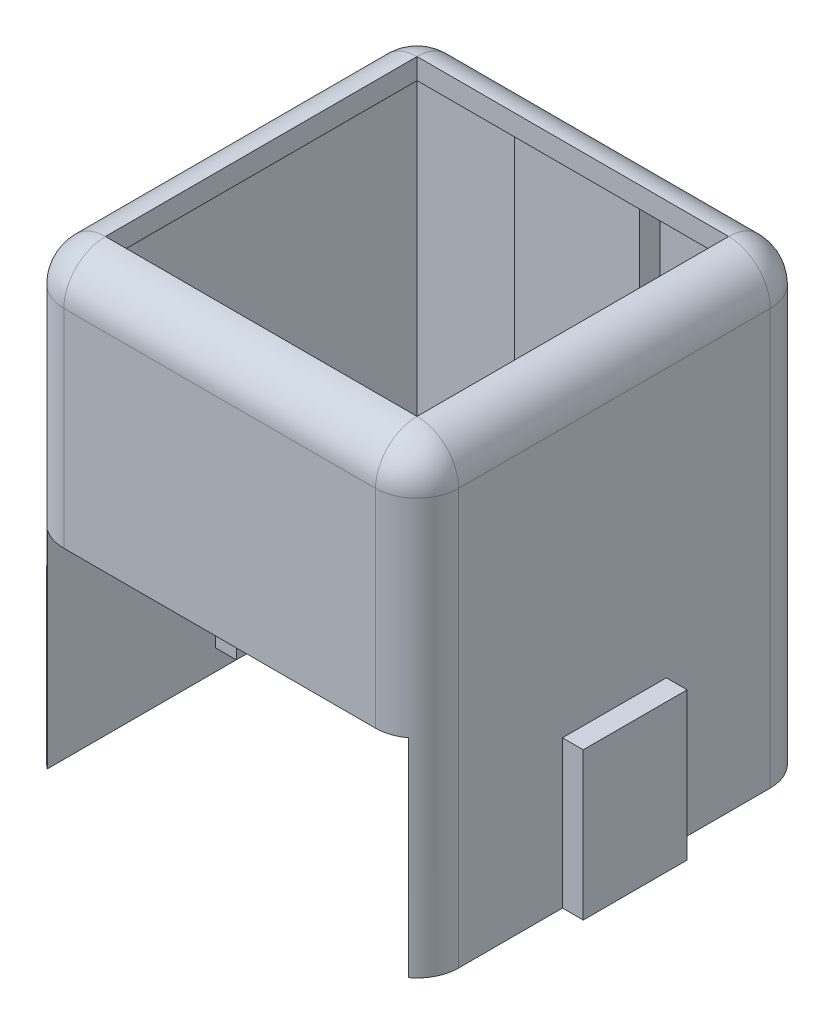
SolidWorks part; units mm, degrees
ref_plane "Front Plane" through (0, 0, 0) normal (0, 0, 1) x (1, 0, 0)
ref_plane "Top Plane" through (0, 0, 0) normal (0, 1, 0) x (1, 0, 0)
ref_plane "Right Plane" through (0, 0, 0) normal (1, 0, 0) x (0, 0, -1)
sketch "Sketch1" plane through (0, 0, 0) normal (0, 1, 0) x (1, 0, 0)
  line L1 (-9.5, -9.5) -> (9.5, -9.5)
  line L2 (-9.5, -9.5) -> (-9.5, 9.5)
  line L3 (-9.5, 9.5) -> (9.5, 9.5)
  line L4 (9.5, -9.5) -> (9.5, 9.5)
  line L5 (-9.5, -9.5) -> (9.5, 9.5) construction
  line L6 (-9.5, 9.5) -> (9.5, -9.5) construction
  point P0 (0, 0)
  dimension "D1" = 19
extrude "Boss-Extrude1" add sketch "Sketch1" along normal blind 22 contours L2 L1 L4 L3
ref_plane "Plane1" through (0, 21, 0) normal (0, 1, 0) x (1, 0, 0)
sketch "Sketch3" plane through (0, 21, 0) normal (0, 1, 0) x (1, 0, 0)
  line L1 (-8.7, -8.7) -> (8.7, -8.7)
  line L2 (-8.7, -8.7) -> (-8.7, 8.7)
  line L3 (-8.7, 8.7) -> (8.7, 8.7)
  line L4 (8.7, -8.7) -> (8.7, 8.7)
  line L5 (-8.7, -8.7) -> (8.7, 8.7) construction
  line L6 (-8.7, 8.7) -> (8.7, -8.7) construction
  point P0 (0, 0)
  dimension "D1" = 17.4
extrude "Cut-Extrude1" cut sketch "Sketch3" against normal blind 21
sketch "Sketch4" plane through (0, 22, 0) normal (0, 1, 0) x (1, 0, 0)
  line L1 (-7.5, -7.5) -> (7.5, -7.5)
  line L2 (-7.5, -7.5) -> (-7.5, 7.5)
  line L3 (-7.5, 7.5) -> (7.5, 7.5)
  line L4 (7.5, -7.5) -> (7.5, 7.5)
  line L5 (-7.5, -7.5) -> (7.5, 7.5) construction
  line L6 (-7.5, 7.5) -> (7.5, -7.5) construction
  point P0 (0, 0)
  dimension "D1" = 15
extrude "Cut-Extrude2" cut sketch "Sketch4" against normal blind 20
ref_plane "Plane2" through (0, 10, 0) normal (0, 1, 0) x (1, 0, 0)
sketch "Sketch6" plane through (0, 0, 9.5) normal (0, 0, 1) x (1, 0, 0)
  line L0 (0, -1000) -> (0, 49000) construction
  line L2 (-8.7, 10) -> (8.7, 10)
  line L3 (-8.7, 10) -> (-8.7, 0)
  line L4 (-8.7, 0) -> (8.7, 0)
  line L5 (8.7, 10) -> (8.7, 0)
  line L6 (-8.7, 10) -> (8.7, 0) construction
  line L7 (-8.7, 0) -> (8.7, 10) construction
  point P1 (0, 5)
  point P8 (0, 10)
  point P9 (0, 0)
  dimension "D1" = 10
  dimension "D2" = 17.4
extrude "Cut-Extrude3" cut sketch "Sketch6" against normal blind 2
ref_plane "Plane3" through (0, 7.1, 0) normal (0, 1, 0) x (1, 0, 0)
sketch "Sketch7" plane through (0, 7.1, 0) normal (0, 1, 0) x (1, 0, 0)
  line L0 (-1000, 0) -> (49000, 0) construction
  line L1 (0, -1000) -> (0, 49000) construction
  line L2 (-9.5, -9.5) -> (-9.5, 9.5) construction
  line L3 (-9.5, -2.5) -> (-10.5, -2.5)
  line L4 (-9.5, -2.5) -> (-9.5, 2.5)
  line L5 (-9.5, 2.5) -> (-10.5, 2.5)
  line L6 (-10.5, -2.5) -> (-10.5, 2.5)
  line L7 (9.5, 2.5) -> (10.5, 2.5)
  line L8 (10.5, -2.5) -> (10.5, 2.5)
  line L9 (9.5, -2.5) -> (10.5, -2.5)
  line L10 (9.5, -2.5) -> (9.5, 2.5)
  point P11 (-10.5, 0)
  dimension "D1" = 5
  dimension "D2" = 1
extrude "Boss-Extrude5" add sketch "Sketch7" against normal through all
sketch "Sketch8" plane through (0, 0, -9.5) normal (0, 0, -1) x (-1, 0, 0)
  line L0 (0, -1000) -> (0, 49000) construction
  line L1 (-1000, 10.1) -> (49000, 10.1) construction
  line L2 (10.45, 7.1) -> (-10.45, 7.1) construction
  circle A0 centre (0, 10.1) radius 3
  dimension "D2" = 6
  dimension "D1" = 3
extrude "Cut-Extrude5" cut sketch "Sketch8" against normal blind 0.5
fillet "Fillet1" radius 2 8 edges at (9.5, 11, -9.5) (9.5, 11, 9.5) (-9.5, 11, 9.5) (0, 22, 9.5) (9.5, 22, 0) (-9.5, 22, 0) (0, 22, -9.5) (-9.5, 11, -9.5)
sketch "Sketch10" plane through (0, 10, 0) normal (0, 1, 0) x (1, 0, 0)
  line L0 (0, -1000) -> (0, 49000) construction
  line L1 (-1000, 0) -> (49000, 0) construction
  line L2 (8.7, -8.7) -> (-8.7, -8.7) construction
  line L3 (-3, -7.7) -> (3, -7.7)
  line L4 (-3, -7.7) -> (-3, -8.7)
  line L5 (-3, -8.7) -> (3, -8.7)
  line L6 (3, -7.7) -> (3, -8.7)
  line L7 (-3, -7.7) -> (3, -8.7) construction
  line L8 (-3, -8.7) -> (3, -7.7) construction
  line L9 (3, 7.7) -> (3, 8.7)
  line L10 (-3, 8.7) -> (3, 8.7)
  line L11 (-3, 7.7) -> (-3, 8.7)
  line L12 (-3, 7.7) -> (3, 7.7)
  point P4 (0, -8.2)
  dimension "D1" = 6
  dimension "D2" = 1
extrude "Boss-Extrude6" add sketch "Sketch10" along normal up to next
sketch "Sketch12" plane through (0, 0, -9) normal (0, 0, -1) x (-1, 0, 0)
  line L0 (0, -1000) -> (0, 49000) construction
  line L1 (-1003, 10.1) -> (48997, 10.1) construction
  line L2 (-2, 9.6) -> (2, 9.6)
  line L3 (-2, 9.6) -> (-2, 10.6)
  line L4 (-2, 10.6) -> (2, 10.6)
  line L5 (2, 9.6) -> (2, 10.6)
  line L6 (-2, 9.6) -> (2, 10.6) construction
  line L7 (-2, 10.6) -> (2, 9.6) construction
  point P1 (0, 10.1)
  point P9 (0, 0)
  dimension "D1" = 10.1
  dimension "D2" = 1
  dimension "D3" = 4
extrude "Cut-Extrude8" cut sketch "Sketch12" against normal up to next
ref_plane "Plane4" through (0, 1, 0) normal (0, 1, 0) x (1, 0, 0)
sketch "Sketch13" plane through (0, 1, 0) normal (0, 1, 0) x (1, 0, 0)
  line L0 (-1000, 0) -> (49000, 0) construction
  line L1 (0, -1000) -> (0, 49000) construction
  line L2 (-8.7, 8.7) -> (-8.7, -8.7) construction
  line L3 (-7.7, 1) -> (-8.7, 1)
  line L4 (-7.7, 1) -> (-7.7, -1)
  line L5 (-7.7, -1) -> (-8.7, -1)
  line L6 (-8.7, 1) -> (-8.7, -1)
  line L7 (-7.7, 1) -> (-8.7, -1) construction
  line L8 (-7.7, -1) -> (-8.7, 1) construction
  line L9 (7.7, -1) -> (8.7, -1)
  line L10 (8.7, 1) -> (8.7, -1)
  line L11 (7.7, 1) -> (8.7, 1)
  line L12 (7.7, 1) -> (7.7, -1)
  point P4 (-8.2, 0)
  dimension "D1" = 2
  dimension "D2" = 1
extrude "Boss-Extrude8" add sketch "Sketch13" along normal blind 2
